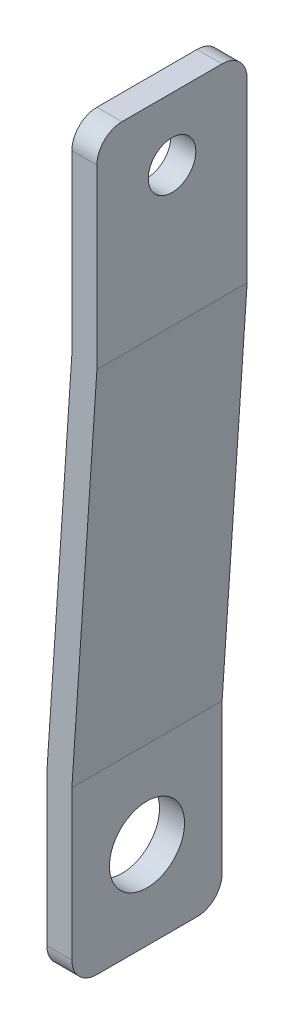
SolidWorks part; units mm, degrees
ref_plane "Plan de face" through (0, 0, 0) normal (0, 0, 1) x (1, 0, 0)
ref_plane "Plan de dessus" through (0, 0, 0) normal (0, 1, 0) x (1, 0, 0)
ref_plane "Plan de droite" through (0, 0, 0) normal (1, 0, 0) x (0, 0, -1)
sketch "Esquisse1" plane through (0, 0, 0) normal (0, 0, 1) x (1, 0, 0)
  line L0 (0, 0) -> (0, -80.3337)
  line L1 (0, -80.3337) -> (-10, -230)
  line L3 (-10, -230) -> (-10, -300)
  dimension "D1" = 150
  dimension "D2" = 70
  dimension "D3" = 300
  dimension "D4" = 10
extrude "Extru.-Mince3" add sketch "Esquisse1" along normal blind 60 thin
fillet "Congé1" radius 10 4 edges at (-5, -300, 0) (-5, -300, 60) (5, 0, 0) (5, 0, 60)
sketch "Esquisse2" plane through (10, 0, 0) normal (1, 0, 0) x (0, 0, -1)
  line L0 (-50, -300) -> (-10, -300) construction
  line L1 (-50, 0) -> (-10, 0) construction
  circle A0 centre (-30, -265) radius 15
  circle A1 centre (-30, -25) radius 9.5
  point P6 (-30, 0)
  dimension "D1" = 30
  dimension "D3" = 19
  dimension "D2" = 35
  dimension "D4" = 25
extrude "Enlèv. mat.-Extru.1" cut sketch "Esquisse2" against normal through all
